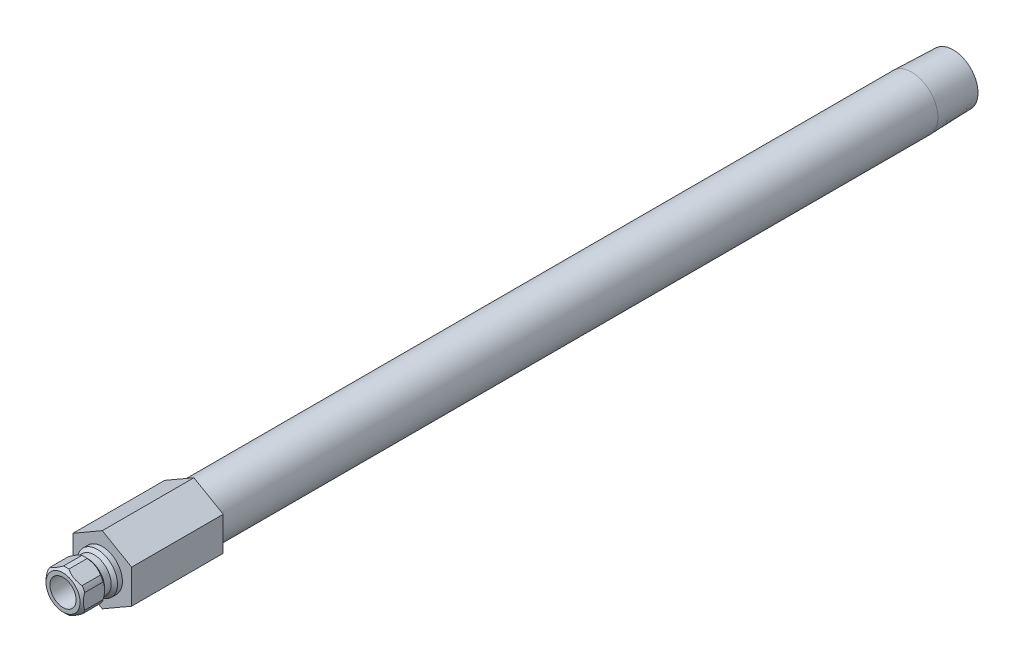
SolidWorks part; units mm, degrees
ref_plane "Front Plane" through (0, 0, 0) normal (0, 0, 1) x (1, 0, 0)
ref_plane "Top Plane" through (0, 0, 0) normal (0, 1, 0) x (1, 0, 0)
ref_plane "Right Plane" through (0, 0, 0) normal (1, 0, 0) x (0, 0, -1)
sketch "Sketch1" plane through (0, 0, 0) normal (1, 0, 0) x (0, 0, -1)
  line L0 (0, 0) -> (-12.7, 0) construction
  line L1 (-9.525, 3.175) -> (-9.525, 4.1275)
  line L2 (-3.556, 4.1275) -> (-3.556, 0) construction
  line L3 (-8.763, 4.8895) -> (-4.318, 4.8895)
  line L4 (0, 6.35) -> (0, 0) construction
  line L5 (-3.556, 4.1275) -> (-1.9685, 4.1275)
  line L6 (-1.2065, 4.8895) -> (0, 4.8895)
  line L7 (0, 4.8895) -> (0, 6.35)
  line L8 (-3.556, 4.1275) -> (-4.318, 4.8895)
  line L9 (-1.9685, 4.1275) -> (-1.2065, 4.8895)
  line L10 (-9.525, 4.1275) -> (-8.763, 4.8895)
  line L11 (22.225, 4.6228) -> (206.375, 4.6228)
  line L12 (0, 6.35) -> (196.342, 6.35)
  line L13 (196.342, 6.35) -> (206.375, 6.0365)
  line L14 (206.375, 6.0365) -> (206.375, 4.6228)
  line L15 (0, 0) -> (22.225, 0) construction
  line L16 (22.225, 0) -> (22.225, 4.8895) construction
  line L17 (22.225, 4.8895) -> (0, 4.8895) construction
  line L18 (22.225, 4.6228) -> (22.225, 3.175)
  line L19 (22.225, 3.175) -> (-9.525, 3.175)
  dimension "D1" = 9.525
  dimension "D2" = 1.5875
  dimension "D3" = 0.762
  dimension "D4" = 45
  dimension "D5" = 5.969
  dimension "D6" = 45
  dimension "D7" = 1.79
  dimension "D8" = 10.033
  dimension "D9" = 215.9
  dimension "D10" = 3.175
  dimension "D11" = 31.75
  dimension "D12" = 9.2456
  dimension "D13" = 6.35
  dimension "D14" = 9.779
  dimension "D15" = 12.7
revolve "Revolve1" add sketch "Sketch1" angle 360 about L0
sketch "Sketch2" plane through (0, 0, 0) normal (0, 0, 1) x (1, 0, 0)
  line L1 (-7.112, 4.1061) -> (-7.112, -4.1061)
  line L2 (-7.112, -4.1061) -> (0, -8.2122)
  line L3 (0, -8.2122) -> (7.112, -4.1061)
  line L4 (7.112, -4.1061) -> (7.112, 4.1061)
  line L5 (7.112, 4.1061) -> (0, 8.2122)
  line L6 (0, 8.2122) -> (-7.112, 4.1061)
  circle A0 centre (0, 0) radius 7.112 construction
  circle A1 centre (0, 0) radius 3.175 construction
  circle A2 centre (0, 0) radius 3.175
  dimension "D1" = 14.224
extrude "Boss-Extrude1" add sketch "Sketch2" against normal up to vertex (22.225 mm away) from vertex at 0
sketch "Sketch3" plane through (0, 0, 0) normal (0, 0, 1) x (1, 0, 0)
  line L1 (4.5212, -2.6103) -> (4.5212, 2.6103)
  line L2 (4.5212, 2.6103) -> (0, 5.2206)
  line L3 (0, 5.2206) -> (-4.5212, 2.6103)
  line L4 (-4.5212, 2.6103) -> (-4.5212, -2.6103)
  line L5 (-4.5212, -2.6103) -> (0, -5.2206)
  line L6 (0, -5.2206) -> (4.5212, -2.6103)
  circle A0 centre (0, 0) radius 4.5212 construction
  dimension "D1" = 9.0424
extrude "Cut-Extrude1" cut sketch "Sketch3" along normal through all from vertex at 3.556 flip side to cut
